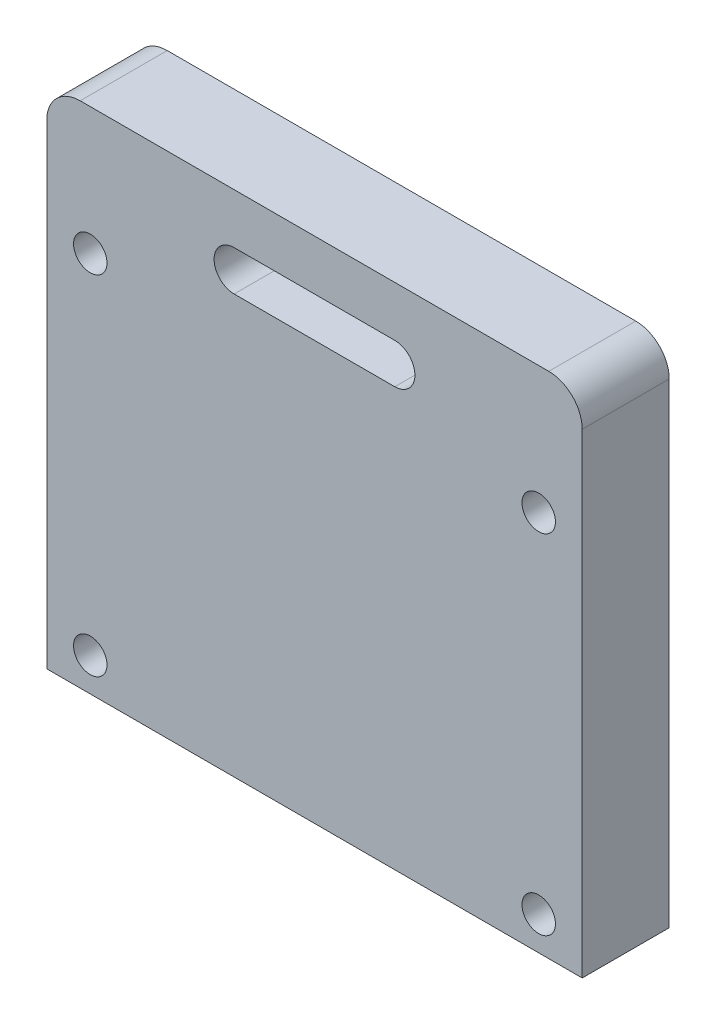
SolidWorks part; units mm, degrees
ref_plane "Ebene vorne" through (0, 0, 0) normal (0, 0, 1) x (1, 0, 0)
ref_plane "Ebene oben" through (0, 0, 0) normal (0, 1, 0) x (1, 0, 0)
ref_plane "Ebene rechts" through (0, 0, 0) normal (1, 0, 0) x (0, 0, -1)
sketch "Skizze1" plane through (0, 0, 0) normal (0, 0, 1) x (1, 0, 0)
  line L1 (-40, 0) -> (40, 0)
  line L2 (-40, 0) -> (-40, 76)
  line L3 (-40, 76) -> (40, 76)
  line L4 (40, 0) -> (40, 76)
  point P4 (0, 0)
  dimension "D1" = 76
  dimension "D2" = 80
extrude "Linear austragen1" add sketch "Skizze1" along normal blind 13
fillet "Verrundung1" radius 5 1 edges at (-40, 76, 6.5)
sketch "Skizze13" plane through (0, 0, 13) normal (0, 0, 1) x (1, 0, 0)
  line L0 (-12, 65.5) -> (12, 65.5) construction
  line L1 (0, 0) -> (0, 76) construction
  line L2 (-40, 0) -> (40, 0) construction
  line L3 (35, 76) -> (-35, 76) construction
  line L4 (-12, 62.5) -> (12, 62.5)
  line L5 (-12, 68.5) -> (12, 68.5)
  arc A0 (-12, 62.5) -> (-12, 68.5) centre (-12, 65.5) cw
  arc A1 (12, 62.5) -> (12, 68.5) centre (12, 65.5) ccw
  point P8 (0, 65.5)
  dimension "D3" = 24
  dimension "D4" = 65.5
  dimension "D1" = 3
  dimension "D2" = 3
extrude "Schnitt-Linear austragen4" cut sketch "Skizze13" against normal through all
hole_wizard "M6 Gewindebohrung1" positions "Skizze15" profile "Skizze14" tap size "M6" standard "DIN"
sketch "Skizze15" plane through (0, 0, 13) normal (0, 0, 1) x (1, 0, 0)
  line L1 (0, 0) -> (0, 76) construction
  line L2 (-40, 0) -> (40, 0) construction
  line L3 (35, 76) -> (-35, 76) construction
  line L5 (-40, 0) -> (40, 0) construction
  point P0 (-33.5, 57)
  point P3 (-33.5, 5)
  point P19 (33.5, 5)
  point P20 (33.5, 57)
  dimension "D1" = 33.5
  dimension "D2" = 57
  dimension "D3" = 5
sketch "Skizze14" plane through (-33.5, 57, 13) normal (1, 0, 0) x (0, -1, 0)
  line L0 (0, 0) -> (0, 13)
  line L1 (0, 13) -> (2.5, 13)
  line L2 (2.5, 13) -> (2.5, 0)
  line L5 (2.5, 0) -> (0, 0)
  line L11 (0, -6.35) -> (0, 107.95) construction
  dimension "Bohrerdurchmesser" = 5
  dimension "Bohrungstiefe" = 13
